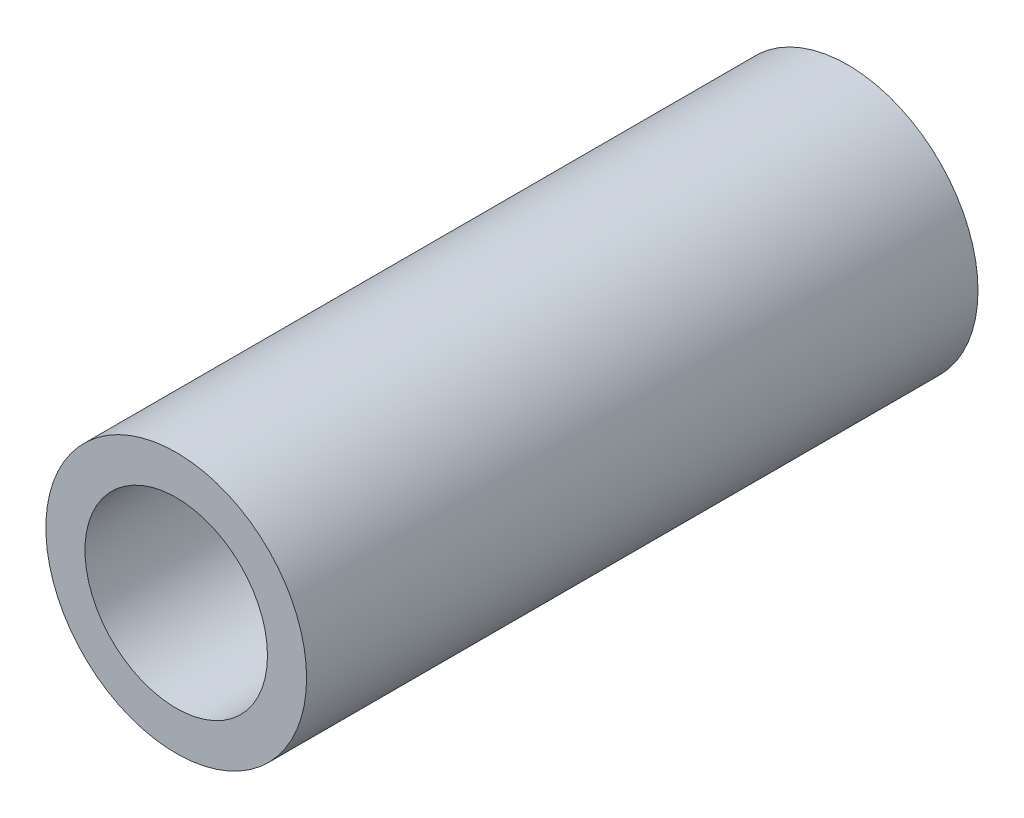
SolidWorks part; units mm, degrees
ref_plane "Front Plane" through (0, 0, 0) normal (0, 0, 1) x (1, 0, 0)
ref_plane "Top Plane" through (0, 0, 0) normal (0, 1, 0) x (1, 0, 0)
ref_plane "Right Plane" through (0, 0, 0) normal (1, 0, 0) x (0, 0, -1)
sketch "Sketch2" plane through (0, 0, 0) normal (0, 0, 1) x (1, 0, 0)
  circle A0 centre (0, 0) radius 10.16
  dimension "D1" = 20.32
extrude "Boss-Extrude1" add sketch "Sketch2" along normal blind 52.324
sketch "Sketch4" plane through (0, 0, 52.324) normal (0, 0, 1) x (1, 0, 0)
  circle A0 centre (0, 0) radius 7.112
  dimension "D1" = 14.224
extrude "Cut-Extrude2" cut sketch "Sketch4" against normal blind 50.8
